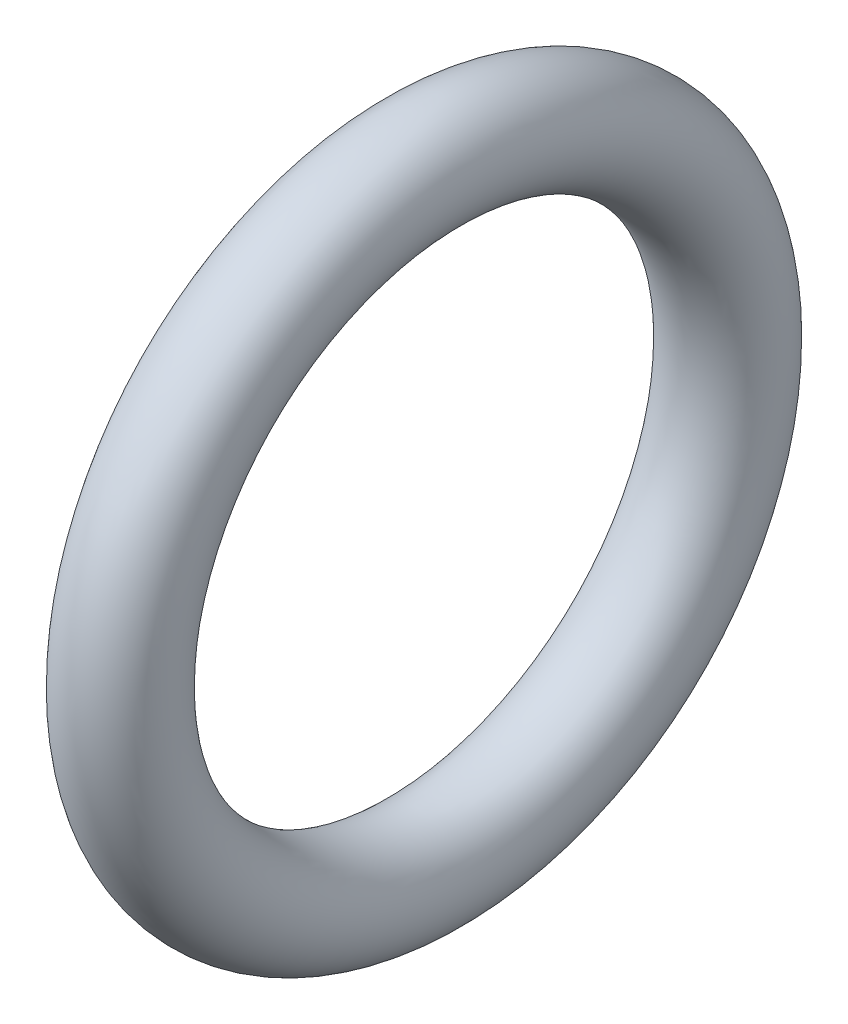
SolidWorks part; units mm, degrees
ref_plane "Спереди" through (0, 0, 0) normal (0, 0, 1) x (1, 0, 0)
ref_plane "Сверху" through (0, 0, 0) normal (0, 1, 0) x (1, 0, 0)
ref_plane "Справа" through (0, 0, 0) normal (1, 0, 0) x (0, 0, -1)
sketch "Эскиз1" plane through (0, 0, 0) normal (0, 0, 1) x (1, 0, 0)
  line L0 (0, 0) -> (0, 7.25) construction
  line L1 (0, 0) -> (2.2748, 0) construction
  circle A0 centre (0, 7.25) radius 1.25
  dimension "D1" = 2.5
  dimension "D2" = 6
  dimension "D3" = 8.5
revolve "Повернуть1" add sketch "Эскиз1" angle 360 about L1
